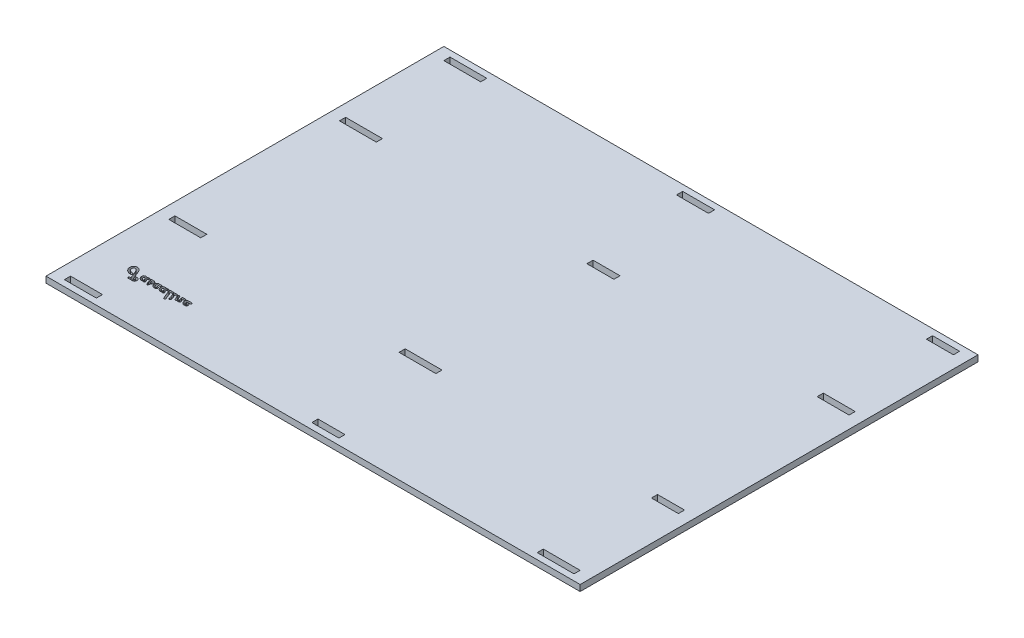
SolidWorks part; units mm, degrees
ref_plane "Front Plane" through (0, 0, 0) normal (0, 0, 1) x (1, 0, 0)
ref_plane "Top Plane" through (0, 0, 0) normal (0, 1, 0) x (1, 0, 0)
ref_plane "Right Plane" through (0, 0, 0) normal (1, 0, 0) x (0, 0, -1)
sketch "Sketch1" plane through (0, 0, 0) normal (0, 1, 0) x (1, 0, 0)
  line L1 (0, 0) -> (276.225, 0)
  line L2 (0, 0) -> (0, -205.74)
  line L3 (0, -205.74) -> (276.225, -205.74)
  line L4 (276.225, 0) -> (276.225, -205.74)
  line L5 (138.1125, -205.74) -> (138.1125, 0) construction
  line L6 (6.35, -57.15) -> (25.4, -57.15)
  line L7 (6.35, -6.35) -> (25.4, -6.35)
  line L8 (6.35, -6.35) -> (6.35, -3.175)
  line L9 (6.35, -3.175) -> (25.4, -3.175)
  line L10 (25.4, -6.35) -> (25.4, -3.175)
  line L11 (126.6825, -6.35) -> (143.1925, -6.35)
  line L12 (126.6825, -6.35) -> (126.6825, -3.175)
  line L13 (126.6825, -3.175) -> (143.1925, -3.175)
  line L14 (143.1925, -6.35) -> (143.1925, -3.175)
  line L15 (255.905, -6.35) -> (269.875, -6.35)
  line L16 (255.905, -6.35) -> (255.905, -3.175)
  line L17 (255.905, -3.175) -> (269.875, -3.175)
  line L18 (269.875, -6.35) -> (269.875, -3.175)
  line L19 (6.35, -57.15) -> (6.35, -60.325)
  line L20 (6.35, -60.325) -> (25.4, -60.325)
  line L21 (25.4, -57.15) -> (25.4, -60.325)
  line L22 (134.3025, -57.15) -> (148.2725, -57.15)
  line L23 (134.3025, -57.15) -> (134.3025, -60.325)
  line L24 (134.3025, -60.325) -> (148.2725, -60.325)
  line L25 (148.2725, -57.15) -> (148.2725, -60.325)
  line L26 (253.365, -57.15) -> (269.875, -57.15)
  line L27 (253.365, -57.15) -> (253.365, -60.325)
  line L28 (253.365, -60.325) -> (269.875, -60.325)
  line L29 (269.875, -57.15) -> (269.875, -60.325)
  line L30 (6.35, -145.415) -> (22.86, -145.415)
  line L31 (6.35, -145.415) -> (6.35, -148.59)
  line L32 (6.35, -148.59) -> (22.86, -148.59)
  line L33 (22.86, -145.415) -> (22.86, -148.59)
  line L34 (125.4125, -145.415) -> (144.4625, -145.415)
  line L35 (125.4125, -145.415) -> (125.4125, -148.59)
  line L36 (125.4125, -148.59) -> (144.4625, -148.59)
  line L37 (144.4625, -145.415) -> (144.4625, -148.59)
  line L38 (255.905, -148.59) -> (269.875, -148.59)
  line L39 (255.905, -148.59) -> (255.905, -145.415)
  line L40 (255.905, -145.415) -> (269.875, -145.415)
  line L41 (269.875, -148.59) -> (269.875, -145.415)
  line L42 (6.35, -202.565) -> (22.86, -202.565)
  line L43 (6.35, -202.565) -> (6.35, -199.39)
  line L44 (6.35, -199.39) -> (22.86, -199.39)
  line L45 (22.86, -202.565) -> (22.86, -199.39)
  line L46 (134.3025, -199.39) -> (148.2725, -199.39)
  line L47 (134.3025, -199.39) -> (134.3025, -202.565)
  line L48 (134.3025, -202.565) -> (148.2725, -202.565)
  line L49 (148.2725, -199.39) -> (148.2725, -202.565)
  line L50 (250.825, -199.39) -> (269.875, -199.39)
  line L51 (250.825, -199.39) -> (250.825, -202.565)
  line L52 (250.825, -202.565) -> (269.875, -202.565)
  line L53 (269.875, -199.39) -> (269.875, -202.565)
  point P21 (134.9375, -6.35)
  point P31 (141.2875, -57.15)
  point P44 (134.9375, -148.59)
  point P58 (141.2875, -202.565)
  dimension "D1" = 205.74
  dimension "D2" = 276.225
  dimension "D3" = 6.35
  dimension "D4" = 19.05
  dimension "D5" = 3.175
  dimension "D6" = 3.175
  dimension "D7" = 6.35
  dimension "D8" = 13.97
  dimension "D9" = 16.51
  dimension "D10" = 3.175
  dimension "D11" = 50.8
  dimension "D12" = 19.05
  dimension "D13" = 13.97
  dimension "D14" = 16.51
  dimension "D15" = 3.175
  dimension "D16" = 16.51
  dimension "D17" = 19.05
  dimension "D18" = 13.97
  dimension "D19" = 3.175
  dimension "D20" = 85.09
  dimension "D21" = 16.51
  dimension "D22" = 19.05
  dimension "D23" = 50.8
  dimension "D24" = 3.175
  dimension "D25" = 13.97
  dimension "D26" = 3.175
extrude "Boss-Extrude1" add sketch "Sketch1" along normal blind 3.175
sketch "Sketch2" plane through (0, 0, 0) normal (0, -1, 0) x (1, 0, 0)
  line L0 (0, 0) -> (0, 205.74) construction
  text T0 "Pascaline" font "Harlow Solid Italic" height in points 18
  dimension "D1" = 17.78
extrude "Cut-Extrude1" cut sketch "Sketch2" against normal through all
